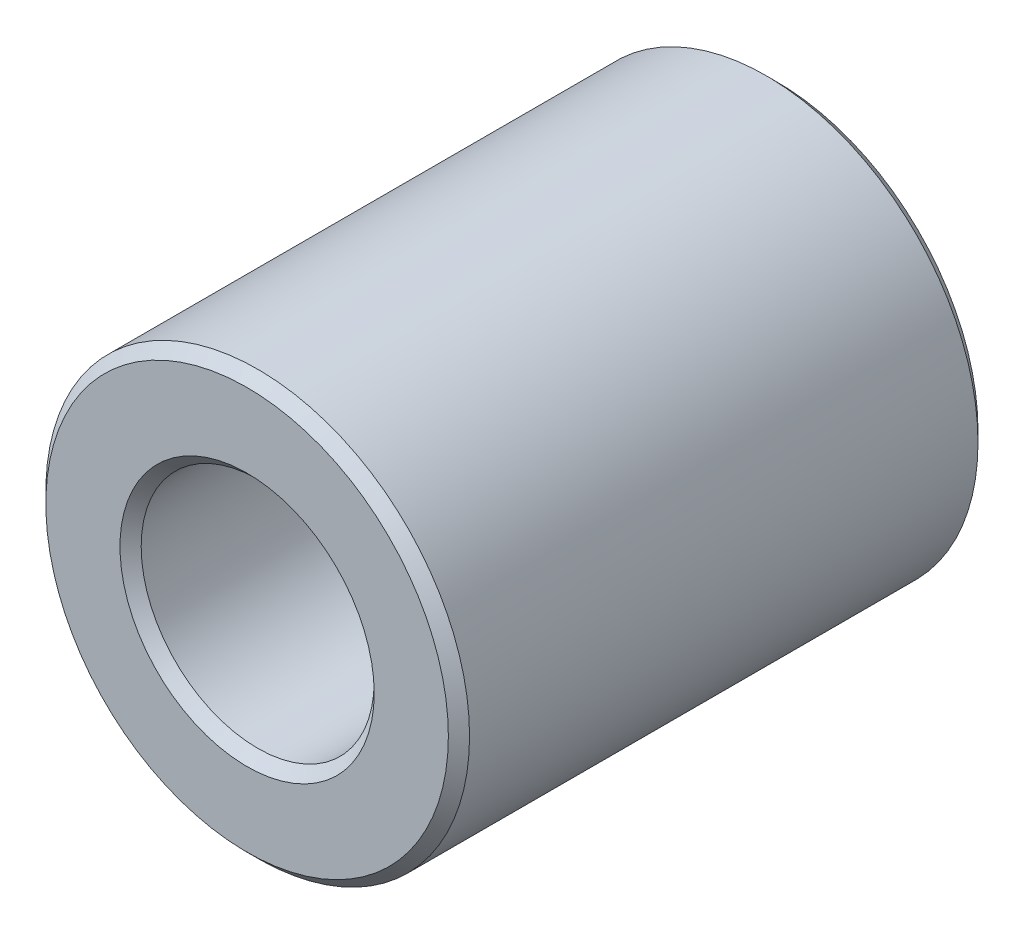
SolidWorks part; units mm, degrees
ref_plane "Front Plane" through (0, 0, 0) normal (0, 0, 1) x (1, 0, 0)
ref_plane "Top Plane" through (0, 0, 0) normal (0, 1, 0) x (1, 0, 0)
ref_plane "Right Plane" through (0, 0, 0) normal (1, 0, 0) x (0, 0, -1)
sketch "Sketch1" plane through (0, 0, 0) normal (0, 0, 1) x (1, 0, 0)
  circle A0 centre (0, 0) radius 2
  circle A1 centre (0, 0) radius 1.1
  dimension "D1" = 4
  dimension "D2" = 2.2
extrude "Boss-Extrude2" add sketch "Sketch1" along normal mid plane 5
chamfer "Chamfer3" distance 0.1 angle 45 4 edges at (2, 0, 2.5) (2, 0, -2.5) (1.1, 0, -2.5) (1.1, 0, 2.5)
